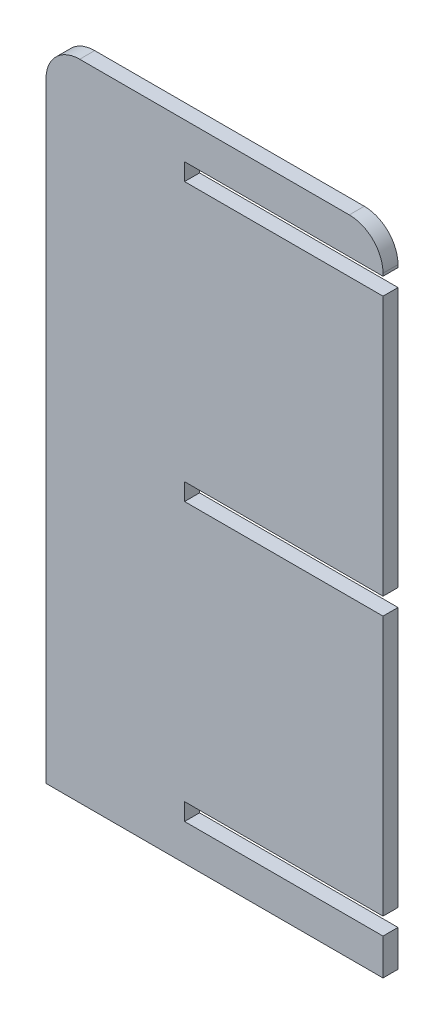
SolidWorks part; units mm, degrees
ref_plane "Alzado" through (0, 0, 0) normal (0, 0, 1) x (1, 0, 0)
ref_plane "Planta" through (0, 0, 0) normal (0, 1, 0) x (1, 0, 0)
ref_plane "Vista lateral" through (0, 0, 0) normal (1, 0, 0) x (0, 0, -1)
sketch "Croquis1" plane through (0, 0, 0) normal (0, 0, 1) x (1, 0, 0)
  line L0 (-222.6705, -649.7924) -> (227.3295, -649.7924)
  line L3 (-222.6705, 165.2076) -> (-222.6705, -649.7924)
  line L4 (227.3295, -649.7924) -> (227.3295, -601.2924)
  line L6 (-37.6705, -601.2924) -> (-37.6705, -578.2924)
  line L8 (227.3295, -578.2924) -> (227.3295, -231.2924)
  line L10 (-37.6705, -231.2924) -> (-37.6705, -208.2924)
  line L12 (227.3295, -208.2924) -> (227.3295, 138.7076)
  line L14 (-37.6705, 138.7076) -> (-37.6705, 161.7076)
  line L16 (227.3295, 161.7076) -> (227.3295, 165.2076)
  line L17 (182.3295, 210.2076) -> (-177.6705, 210.2076)
  line L22 (227.3295, 138.7076) -> (-37.6705, 138.7076)
  line L23 (-37.6705, 161.7076) -> (227.3295, 161.7076)
  line L24 (227.3295, -231.2924) -> (-37.6705, -231.2924)
  line L25 (-37.6705, -208.2924) -> (227.3295, -208.2924)
  line L26 (227.3295, -601.2924) -> (-37.6705, -601.2924)
  line L27 (-37.6705, -578.2924) -> (227.3295, -578.2924)
  arc A0 (-177.6705, 210.2076) -> (-222.6705, 165.2076) centre (-177.6705, 165.2076) ccw
  arc A1 (227.3295, 165.2076) -> (182.3295, 210.2076) centre (182.3295, 165.2076) ccw
  point P20 (227.3295, 210.2076)
  dimension "D13" = 45
  dimension "D14" = 45
  dimension "D1" = 450
  dimension "D4" = 185
  dimension "D6" = 185
  dimension "D16" = 450
extrude "Saliente-Extruir1" add sketch "Croquis1" along normal blind 20
